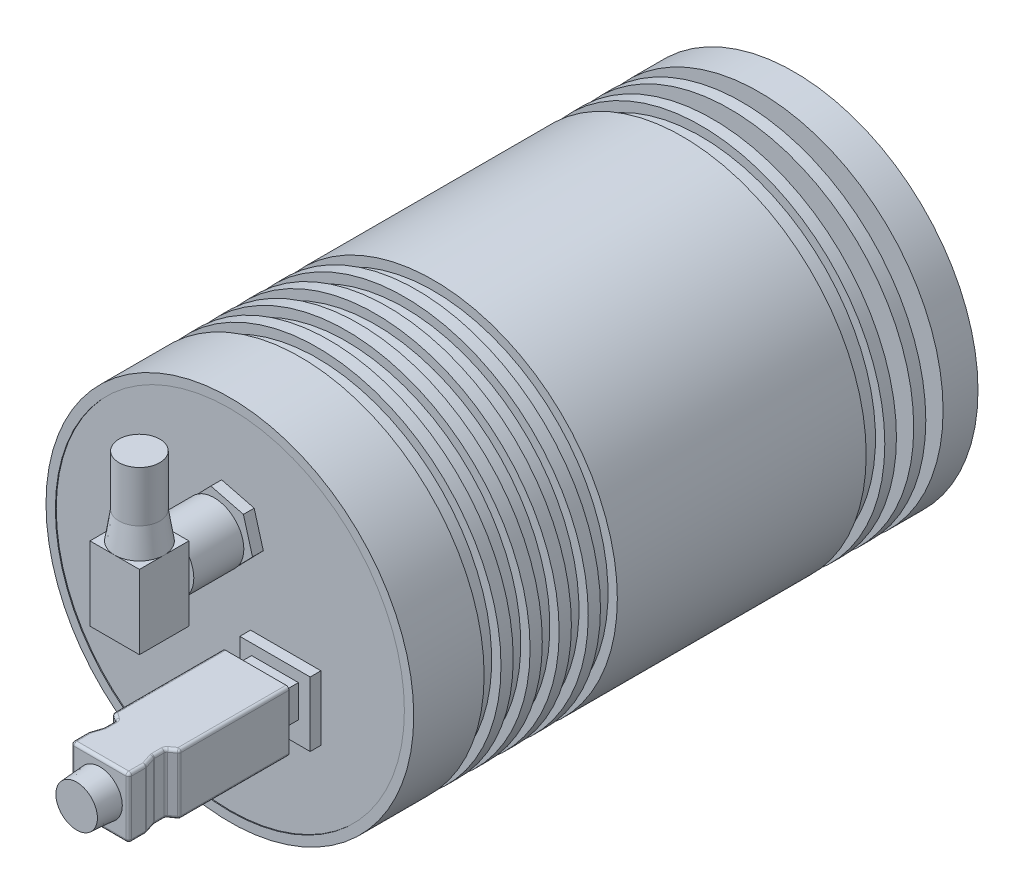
SolidWorks part; units mm, degrees
ref_plane "Front" through (0, 0, 0) normal (0, 0, 1) x (1, 0, 0)
ref_plane "Top" through (0, 0, 0) normal (0, 1, 0) x (1, 0, 0)
ref_plane "Right" through (0, 0, 0) normal (1, 0, 0) x (0, 0, -1)
sketch "Sketch1" plane through (0, 0, 0) normal (0, 0, 1) x (1, 0, 0)
  circle A0 centre (0, 0) radius 31.61
  dimension "D1" = 63.22
extrude "Extrude1" add sketch "Sketch1" along normal blind 97
sketch "Sketch2" plane through (0, 0, 0) normal (0, 1, 0) x (1, 0, 0)
  line L0 (31.61, -97) -> (31.61, 0) construction
  line L1 (24.86, -6) -> (31.61, -6)
  line L2 (24.86, -6) -> (24.86, -8.97)
  line L3 (24.86, -8.97) -> (31.61, -8.97)
  line L4 (31.61, -6) -> (31.61, -8.97)
  line L5 (31.61, 0) -> (-31.61, 0) construction
  line L6 (0, 0) -> (0, -99.1638) construction
  dimension "D1" = 2.97
  dimension "D2" = 6.75
  dimension "D3" = 6
revolve "Cut-Revolve1" cut sketch "Sketch2" angle 360 about L6
pattern_linear "LPattern1" count 2 spacing 5.05 along (0, 0, 1) of "Cut-Revolve1"
sketch "Sketch3" plane through (0, 0, 0) normal (0, 1, 0) x (1, 0, 0)
  line L0 (31.61, -97) -> (31.61, -14.02) construction
  line L1 (30.01, -16.02) -> (31.61, -16.02)
  line L2 (30.01, -16.02) -> (30.01, -19.22)
  line L3 (30.01, -19.22) -> (31.61, -19.22)
  line L4 (31.61, -16.02) -> (31.61, -19.22)
  line L5 (24.86, -14.02) -> (-24.86, -14.02) construction
  line L6 (0, 0) -> (0, -22.0931) construction
  line L7 (0, -11.05) -> (0, -8.97) construction
  dimension "D1" = 1.6
  dimension "D2" = 3.2
  dimension "D3" = 2
revolve "Cut-Revolve2" cut sketch "Sketch3" angle 360 about L6
sketch "Sketch4" plane through (0, 0, 0) normal (0, 1, 0) x (1, 0, 0)
  line L0 (31.61, -97) -> (31.61, -19.22) construction
  line L1 (30.01, -82) -> (31.61, -82)
  line L2 (30.01, -82) -> (30.01, -84.9)
  line L3 (30.01, -84.9) -> (31.61, -84.9)
  line L4 (31.61, -82) -> (31.61, -84.9)
  line L5 (0, 0) -> (0, -77.4429) construction
  line L6 (0, -16.02) -> (0, -14.02) construction
  line L7 (-31.61, -97) -> (31.61, -97) construction
  dimension "D1" = 2.9
  dimension "D2" = 1.6
  dimension "D3" = 12.1
revolve "Cut-Revolve3" cut sketch "Sketch4" angle 360 about L5
pattern_linear "LPattern2" count 5 spacing 5 along (0, 0, -1) of "Cut-Revolve3"
sketch "Sketch13" plane through (0, 0, 97) normal (0, 0, 1) x (1, 0, 0)
  circle A0 centre (0, 0) radius 30
  dimension "D1" = 60
extrude "Cut-Extrude2" cut sketch "Sketch13" against normal blind 0.15
sketch "Sketch5" plane through (0, 0, 97) normal (0, 0, -1) x (-1, 0, 0)
  line L1 (-15.507, -1.384) -> (-3.407, -1.384)
  line L2 (-15.507, -1.384) -> (-15.507, -12.484)
  line L3 (-15.507, -12.484) -> (-3.407, -12.484)
  line L4 (-3.407, -1.384) -> (-3.407, -12.484)
  circle A0 centre (0, 0) radius 31.61 construction
  dimension "D1" = 30.226
  dimension "D2" = 11.1
  dimension "D3" = 12.1
  dimension "D4" = 47.117
extrude "Extrude2" add sketch "Sketch5" against normal blind 1.7 and the other way up to surface (97 mm away)
sketch "Sketch14" plane through (0, 0, 96.85) normal (0, 0, 1) x (1, 0, 0)
  line L3 (-4.0276, 8.8125) -> (1.5687, 7.3929)
  line L4 (1.5687, 7.3929) -> (5.5962, 11.5296)
  line L5 (5.5962, 11.5296) -> (4.0276, 17.0859)
  line L6 (4.0276, 17.0859) -> (-1.5687, 18.5055)
  line L7 (-1.5687, 18.5055) -> (-5.5962, 14.3688)
  line L8 (-5.5962, 14.3688) -> (-4.0276, 8.8125)
  circle A0 centre (0, 12.9492) radius 3.9 construction
  circle A1 centre (0, 12.9492) radius 5 construction
  circle A2 centre (0, 0) radius 30 construction
  dimension "D1" = 7.8
  dimension "D2" = 12.9492
  dimension "D4" = 10
extrude "Extrude7" add sketch "Sketch14" along normal blind 1.85
sketch "Sketch15" plane through (0, 0, 98.7) normal (0, 0, 1) x (1, 0, 0)
  circle A0 centre (0, 12.9492) radius 3.27
  circle A2 centre (0, 12.9492) radius 3.9 construction
  dimension "D1" = 6.54
extrude "Extrude8" add sketch "Sketch15" along normal blind 1
sketch "Sketch16" plane through (0, 0, 99.7) normal (0, 0, 1) x (1, 0, 0)
  circle A0 centre (0, 12.9492) radius 5.1
  dimension "D1" = 10.2
extrude "Extrude9" add sketch "Sketch16" along normal blind 8.6
sketch "Sketch17" plane through (0, 0, 108.3) normal (0, 0, 1) x (1, 0, 0)
  line L1 (4.25, 5.3492) -> (-4.25, 5.3492)
  line L2 (4.25, 5.3492) -> (4.25, 18.0492)
  line L3 (4.25, 18.0492) -> (-4.25, 18.0492)
  line L4 (-4.25, 5.3492) -> (-4.25, 18.0492)
  circle A1 centre (0, 12.9492) radius 5.1 construction
  point P4 (0, 18.0492)
  dimension "D1" = 12.7
  dimension "D2" = 8.5
extrude "Extrude10" add sketch "Sketch17" along normal blind 8.5
sketch "Sketch18" plane through (0, 18.0492, 0) normal (0, -1, 0) x (1, 0, 0)
  line L0 (4.25, 116.8) -> (4.25, 108.3) construction
  line L1 (-4.25, 116.8) -> (4.25, 116.8) construction
  line L2 (-4.25, 116.8) -> (-4.25, 108.3) construction
  circle A0 centre (0, 112.55) radius 4.25
extrude "Extrude11" add sketch "Sketch18" against normal blind 4.7 draft 9
sketch "Sketch19" plane through (0, 22.7492, 0) normal (0, 1, 0) x (-1, 0, 0)
  circle A0 centre (0, 112.55) radius 3.5056
  circle A1 centre (0, 112.55) radius 3.5056 construction
extrude "Extrude12" add sketch "Sketch19" along normal blind 8.7
sketch "Sketch20" plane through (0, 31.4492, 0) normal (0, 1, 0) x (-1, 0, 0)
  circle A0 centre (0, 112.55) radius 2.25
  dimension "D1" = 4.5
extrude "Extrude13" [suppressed] add sketch "Sketch20" along normal blind 48.7
sketch "Sketch6" plane through (0, 0, 98.7) normal (0, 0, 1) x (1, 0, 0)
  line L0 (15.507, -12.484) -> (3.407, -12.484) construction
  line L1 (5.432, -3.234) -> (13.482, -3.234)
  line L2 (5.432, -3.234) -> (5.432, -10.484)
  line L3 (5.432, -10.484) -> (13.482, -10.484)
  line L4 (13.482, -3.234) -> (13.482, -10.484)
  line L7 (9.457, -1.384) -> (9.457, -12.484) construction
  line L8 (3.407, -1.384) -> (15.507, -1.384) construction
  line L9 (15.507, -12.484) -> (3.407, -12.484) construction
  point P16 (9.457, -3.234)
  dimension "D1" = 8.05
  dimension "D2" = 7.25
  dimension "D3" = 2
extrude "Extrude3" add sketch "Sketch6" along normal blind 3.3
chamfer "Chamfer1" distance 1.7 angle 45 2 edges at (13.482, -10.484, 100.35) (5.432, -10.484, 100.35)
sketch "Sketch7" plane through (0, 0, 102) normal (0, 0, 1) x (1, 0, 0)
  line L0 (3.407, -1.384) -> (15.507, -1.384) construction
  line L1 (3.757, -1.384) -> (15.157, -1.384)
  line L2 (3.757, -1.384) -> (3.757, -11.784)
  line L3 (3.757, -11.784) -> (15.157, -11.784)
  line L4 (15.157, -1.384) -> (15.157, -11.784)
  point P4 (9.457, -1.384)
  dimension "D1" = 11.4
  dimension "D2" = 10.4
extrude "Extrude4" add sketch "Sketch7" along normal blind 26.8
sketch "Sketch8" plane through (0, -11.784, 0) normal (0, -1, 0) x (1, 0, 0)
  line L0 (15.157, 120.8) -> (13.757, 121.8)
  line L1 (5.157, 122.8) -> (13.757, 122.8) construction
  line L2 (13.757, 121.8) -> (13.757, 123.8)
  line L3 (13.757, 123.8) -> (14.407, 125.8)
  line L4 (14.407, 125.8) -> (14.407, 128.8)
  line L5 (3.757, 128.8) -> (15.157, 128.8) construction
  line L6 (14.407, 128.8) -> (4.507, 128.8)
  line L7 (4.507, 128.8) -> (4.507, 125.8)
  line L8 (4.507, 125.8) -> (5.157, 123.8)
  line L9 (5.157, 123.8) -> (5.157, 121.8)
  line L10 (5.157, 121.8) -> (3.757, 120.8)
  line L13 (9.457, 122.8) -> (9.457, 128.8) construction
  line L14 (3.757, 128.8) -> (3.757, 102) construction
  line L15 (15.157, 128.8) -> (15.157, 102) construction
  line L16 (15.157, 120.8) -> (15.157, 134.7647)
  line L17 (3.757, 120.8) -> (3.757, 134.7647)
  line L18 (3.757, 134.7647) -> (15.157, 134.7647)
  point P16 (9.457, 128.8)
  point P23 (9.457, 122.8)
  dimension "D1" = 8.6
  dimension "D2" = 9.9
  dimension "D3" = 2
  dimension "D4" = 2
  dimension "D5" = 1
  dimension "D6" = 3
extrude "Cut-Extrude1" cut sketch "Sketch8" against normal through all
sketch "Sketch9" plane through (0, 0, 128.8) normal (0, 0, 1) x (1, 0, 0)
  line L0 (4.507, -1.384) -> (14.407, -11.784) construction
  circle A0 centre (9.457, -6.584) radius 3.85
  dimension "D1" = 7.7
extrude "Extrude5" add sketch "Sketch9" along normal blind 4 draft 4
fillet "Fillet1" radius 0.5 32 edges at (9.457, -1.384, 128.8) (9.457, -11.784, 128.8) (14.407, -6.584, 128.8) (14.407, -6.584, 125.8) (13.757, -6.584, 123.8) (13.757, -6.584, 121.8) (15.157, -6.584, 120.8) (4.507, -6.584, 128.8) (4.507, -6.584, 125.8) (5.157, -6.584, 123.8) (5.157, -6.584, 121.8) (3.757, -6.584, 120.8) (4.507, -11.784, 127.3) (4.832, -11.784, 124.8) (5.157, -11.784, 122.8) (4.457, -11.784, 121.3) (3.757, -11.784, 111.4) (14.407, -11.784, 127.3) (14.082, -11.784, 124.8) (13.757, -11.784, 122.8) (14.457, -11.784, 121.3) (15.157, -11.784, 111.4) (14.407, -1.384, 127.3) (14.082, -1.384, 124.8) (13.757, -1.384, 122.8) (14.457, -1.384, 121.3) (15.157, -1.384, 111.4) (4.507, -1.384, 127.3) (4.832, -1.384, 124.8) (5.157, -1.384, 122.8) (4.457, -1.384, 121.3) (3.757, -1.384, 111.4)
sketch "Sketch10" plane through (0, 0, 132.8) normal (0, 0, 1) x (1, 0, 0)
  circle A0 centre (9.457, -6.584) radius 3.5703 construction
  point P0 (9.457, -6.584)
ref_plane "Plane1" through (9.457, 0, 0) normal (1, 0, 0) x (0, 0, -1)
sketch "Sketch11" plane through (9.457, 0, 0) normal (1, 0, 0) x (0, 0, -1)
  line L0 (-137.8, -1.584) -> (-137.8, 66.99)
  line L2 (-132.8, -1.584) -> (-132.8, -6.584) construction
  line L3 (-128.8, -6.584) -> (-132.8, -6.584) construction
  arc A0 (-137.8, -1.584) -> (-132.8, -6.584) centre (-132.8, -1.584) ccw
  dimension "D1" = 10
sketch "Sketch12" plane through (0, 0, 132.8) normal (0, 0, 1) x (1, 0, 0)
  circle A0 centre (9.457, -6.584) radius 2.425
  dimension "D1" = 4.85
sweep "Sweep1" [suppressed] add profiles "Sketch12" path "Sketch11"
chamfer "Chamfer2" [suppressed] distance 0.8 angle 60
